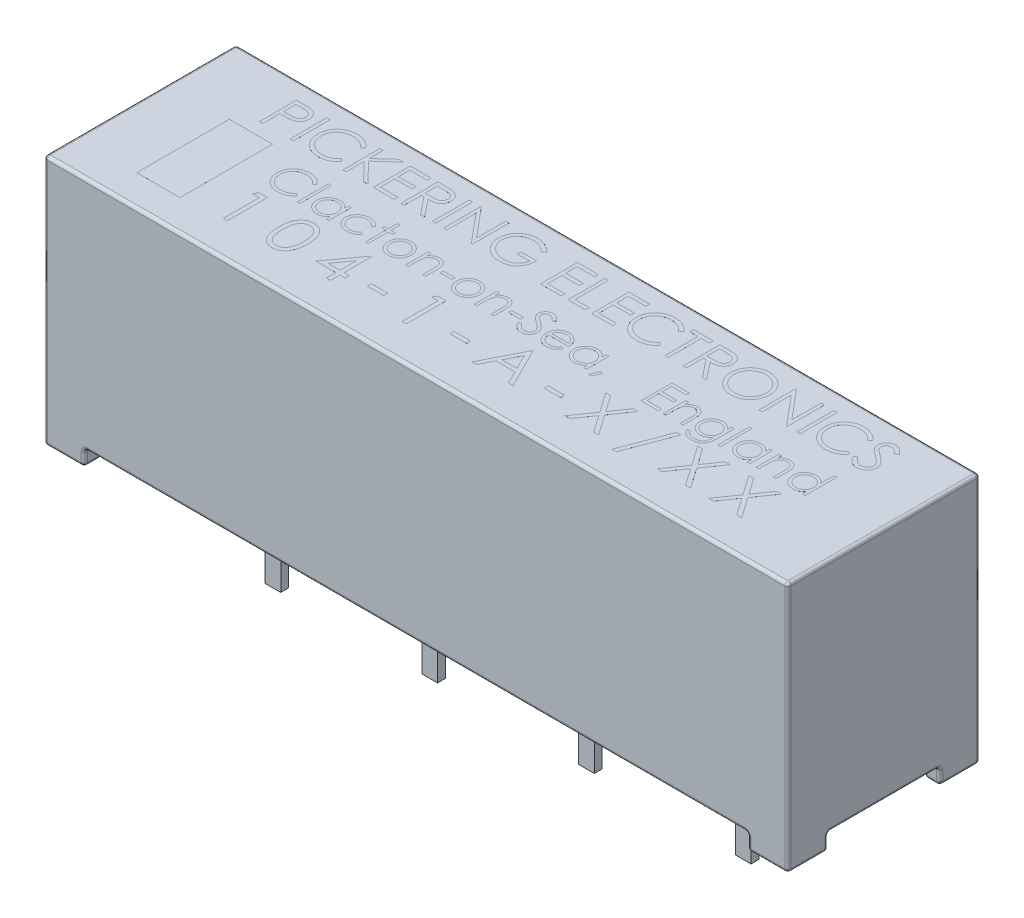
SolidWorks part; units mm, degrees
ref_plane "Front Plane" through (0, 0, 0) normal (0, 0, 1) x (1, 0, 0)
ref_plane "Top Plane" through (0, 0, 0) normal (0, 1, 0) x (1, 0, 0)
ref_plane "Right Plane" through (0, 0, 0) normal (1, 0, 0) x (0, 0, -1)
sketch "Sketch1" plane through (0, 0, 0) normal (0, 1, 0) x (1, 0, 0)
  line L1 (12.05, -3.11) -> (-12.05, -3.11)
  line L2 (12.05, -3.11) -> (12.05, 3.11)
  line L3 (12.05, 3.11) -> (-12.05, 3.11)
  line L4 (-12.05, -3.11) -> (-12.05, 3.11)
  line L5 (12.05, -3.11) -> (-12.05, 3.11) construction
  line L6 (12.05, 3.11) -> (-12.05, -3.11) construction
  point P0 (0, 0)
  dimension "D1" = 6.22
  dimension "D2" = 24.1
extrude "Main Body" add sketch "Sketch1" along normal blind 7.622
sketch "Sketch2" plane through (0, 0, 0) normal (0, -1, 0) x (1, 0, 0)
  line L1 (-12.05, 3.11) -> (-10.75, 3.11)
  line L2 (-12.05, 3.11) -> (-12.05, 1.81)
  line L3 (-12.05, 1.81) -> (-11.5605, 1.81)
  line L4 (-10.75, 3.11) -> (-10.75, 2.5307)
  line L7 (-10.75, 2.5307) -> (-11.5605, 2.5307)
  line L8 (-11.5605, 1.81) -> (-11.5605, 2.5307)
  dimension "D1" = 1.3
  dimension "D2" = 1.3
extrude "Original foot" add sketch "Sketch2" along normal blind 0.508
mirror "Left foot" about plane through (0, 0, 0) normal (0, 0, 1) of "Original foot"
mirror "Right Feet" about plane through (0, 0, 0) normal (1, 0, 0) of "Left foot", "Original foot"
sketch "Sketch3" plane through (0, 0, 0) normal (0, -1, 0) x (1, 0, 0)
  line L0 (12.05, 1.81) -> (12.05, -1.81) construction
  line L1 (-7.366, -0.127) -> (-7.874, -0.127)
  line L2 (-7.366, -0.127) -> (-7.366, 0.127)
  line L3 (-7.366, 0.127) -> (-7.874, 0.127)
  line L4 (-7.874, -0.127) -> (-7.874, 0.127)
  line L5 (-7.366, -0.127) -> (-7.874, 0.127) construction
  line L6 (-7.366, 0.127) -> (-7.874, -0.127) construction
  line L7 (-2.794, -0.127) -> (-2.286, -0.127)
  line L8 (-2.794, -0.127) -> (-2.794, 0.127)
  line L9 (-2.794, 0.127) -> (-2.286, 0.127)
  line L10 (-2.286, -0.127) -> (-2.286, 0.127)
  line L11 (-2.794, -0.127) -> (-2.286, 0.127) construction
  line L12 (-2.794, 0.127) -> (-2.286, -0.127) construction
  line L13 (7.874, -0.127) -> (7.366, -0.127)
  line L14 (7.874, -0.127) -> (7.874, 0.127)
  line L15 (7.874, 0.127) -> (7.366, 0.127)
  line L16 (7.366, -0.127) -> (7.366, 0.127)
  line L17 (7.874, -0.127) -> (7.366, 0.127) construction
  line L18 (7.874, 0.127) -> (7.366, -0.127) construction
  line L19 (2.286, -0.127) -> (2.794, -0.127)
  line L20 (2.286, -0.127) -> (2.286, 0.127)
  line L21 (2.286, 0.127) -> (2.794, 0.127)
  line L22 (2.794, -0.127) -> (2.794, 0.127)
  line L23 (2.286, -0.127) -> (2.794, 0.127) construction
  line L24 (2.286, 0.127) -> (2.794, -0.127) construction
  point P0 (-7.62, 0)
  point P5 (-2.54, 0)
  point P10 (7.62, 0)
  point P15 (2.54, 0)
  dimension "D1" = 0.508
  dimension "D2" = 0.254
  dimension "D3" = 0.508
  dimension "D4" = 0.254
  dimension "D5" = 0.508
  dimension "D6" = 0.254
  dimension "D7" = 0.508
  dimension "D8" = 0.254
  dimension "D9" = 5.08
  dimension "D10" = 5.08
  dimension "D11" = 5.08
  dimension "D12" = 4.43
extrude "Pins" add sketch "Sketch3" along normal blind 3.808
sketch "Sketch4"
  dimension "D1" = 19.3
  dimension "D2" = 17.5
  dimension "D3" = 17.5
  dimension "D4" = 1.8
  dimension "D5" = 1.65
  dimension "D6" = 1.65
  dimension "D7" = 2.4
  dimension "D8" = 3
  dimension "D9" = 1.4
  dimension "D10" = 2
  dimension "D11" = 1
extrude "Lettering" add sketch "Sketch4" along normal blind 0.0001
fillet "Fillet1" radius 0.1 72 edges at (11.5605, -0.254, -1.81) (12.05, -0.254, -1.81) (12.05, -0.254, 1.81) (11.5605, -0.254, 1.81) (11.1553, 0, -2.5307) (11.8053, 0, -1.81) (11.8053, 0, 1.81) (11.1553, 0, 2.5307) (-11.1553, 0, 2.5307) (-11.1553, 0, -2.5307) (-11.1553, -0.508, -2.5307) (-11.4, -0.508, -3.11) (-12.05, -0.508, -2.46) (10.75, -0.254, -2.5307) (10.75, -0.254, -3.11) (10.75, 0, -2.8203) (11.5605, -0.254, -2.5307) (11.5605, 0, -2.1703) (11.5605, -0.254, 2.5307) (11.5605, 0, 2.1703) (10.75, -0.254, 2.5307) (10.75, -0.254, 3.11) (10.75, 0, 2.8203) (-11.5605, -0.254, 1.81) (-11.5605, -0.254, 2.5307) (-11.5605, 0, 2.1703) (-10.75, -0.254, 2.5307) (-11.8053, -0.508, -1.81) (-12.05, -0.254, -1.81) (-11.5605, -0.254, -1.81) (-11.8053, 0, -1.81) (-11.5605, -0.254, -2.5307) (-11.5605, -0.508, -2.1703) (-11.5605, 0, -2.1703) (-10.75, -0.254, -2.5307) (-10.75, -0.254, -3.11) (-10.75, -0.508, -2.8203) (-10.75, 0, -2.8203) (-11.4, -0.508, 3.11) (-10.75, -0.508, 2.8203) (-11.1553, -0.508, 2.5307) (-11.5605, -0.508, 2.1703) (-11.8053, -0.508, 1.81) (-12.05, -0.508, 2.46) (11.4, -0.508, -3.11) (10.75, -0.508, -2.8203) (11.1553, -0.508, -2.5307) (11.5605, -0.508, -2.1703) (11.8053, -0.508, -1.81) (12.05, -0.508, -2.46) (11.8053, -0.508, 1.81) (11.5605, -0.508, 2.1703) (11.1553, -0.508, 2.5307) (10.75, -0.508, 2.8203) (11.4, -0.508, 3.11) (12.05, -0.508, 2.46) (12.05, 0, 0) (0, 0, -3.11) (0, 7.622, -3.11) (12.05, 3.557, -3.11) (12.05, 7.622, 0) (12.05, 3.557, 3.11) (0, 7.622, 3.11) (-12.05, 7.622, 0) (-12.05, 3.557, -3.11) (-12.05, 3.557, 3.11)
